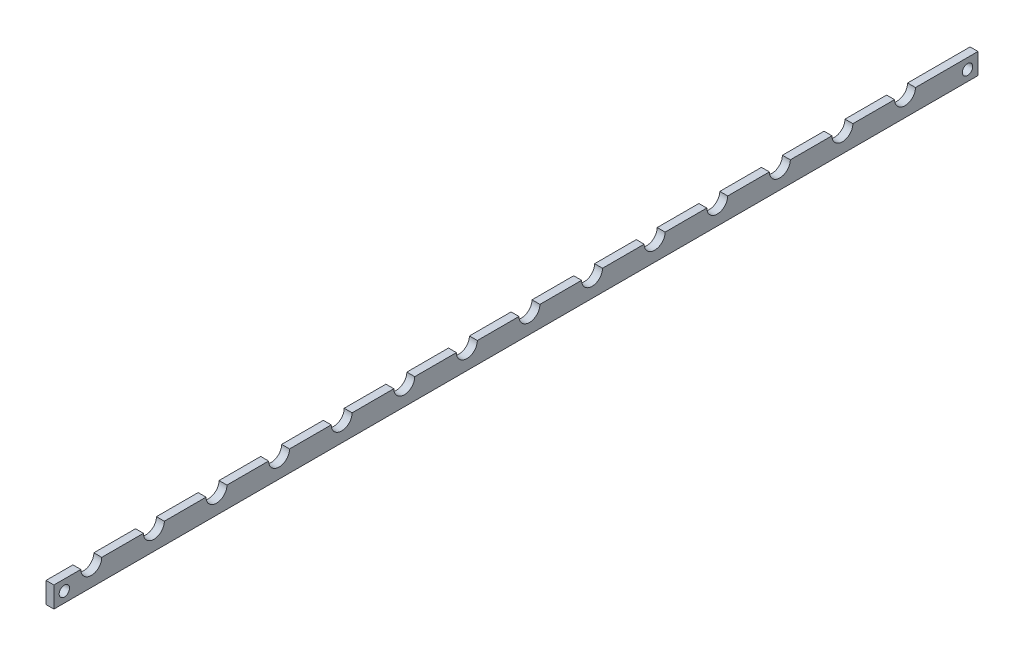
SolidWorks part; units mm, degrees
ref_plane "Alzado" through (0, 0, 0) normal (0, 0, 1) x (1, 0, 0)
ref_plane "Planta" through (0, 0, 0) normal (0, 1, 0) x (1, 0, 0)
ref_plane "Vista lateral" through (0, 0, 0) normal (1, 0, 0) x (0, 0, -1)
sketch "Croquis1" plane through (0, 0, 0) normal (1, 0, 0) x (0, 0, -1)
  line L1 (0, 0) -> (561, 0)
  line L2 (0, 0) -> (0, -12.7)
  line L3 (0, -12.7) -> (561, -12.7)
  line L4 (561, 0) -> (561, -12.7)
  dimension "D1" = 561
  dimension "D2" = 12.7
extrude "Saliente-Extruir1" add sketch "Croquis1" along normal blind 4.8
sketch "Croquis3" plane through (4.8, 0, 0) normal (1, 0, 0) x (0, 0, -1)
  line L2 (561, -12.7) -> (561, 0) construction
  line L3 (561, 0) -> (0, 0) construction
  circle A0 centre (516.7, 0) radius 6.35
  dimension "D1" = 12.7
  dimension "D2" = 44.3
  dimension "D3" = 0
extrude "DESC_TUBERIA" cut sketch "Croquis3" against normal through all
pattern_linear "MatrizL1" count 14 spacing 38 along (0, 0, 1) of "DESC_TUBERIA"
sketch "Croquis5" plane through (4.8, 0, 0) normal (1, 0, 0) x (0, 0, -1)
  line L0 (561, 0) -> (523.05, 0) construction
  line L1 (561, -12.7) -> (561, 0) construction
  line L2 (0, 0) -> (0, -12.7) construction
  line L3 (16.35, 0) -> (0, 0) construction
  circle A0 centre (554.65, -6.35) radius 3.15
  circle A1 centre (6.35, -6.35) radius 3.15
  dimension "D1" = 6.3
  dimension "D4" = 6.3
  dimension "D2" = 6.35
  dimension "D3" = 6.35
  dimension "D5" = 6.35
  dimension "D6" = 6.35
extrude "Cortar-Extruir2" cut sketch "Croquis5" against normal through all
